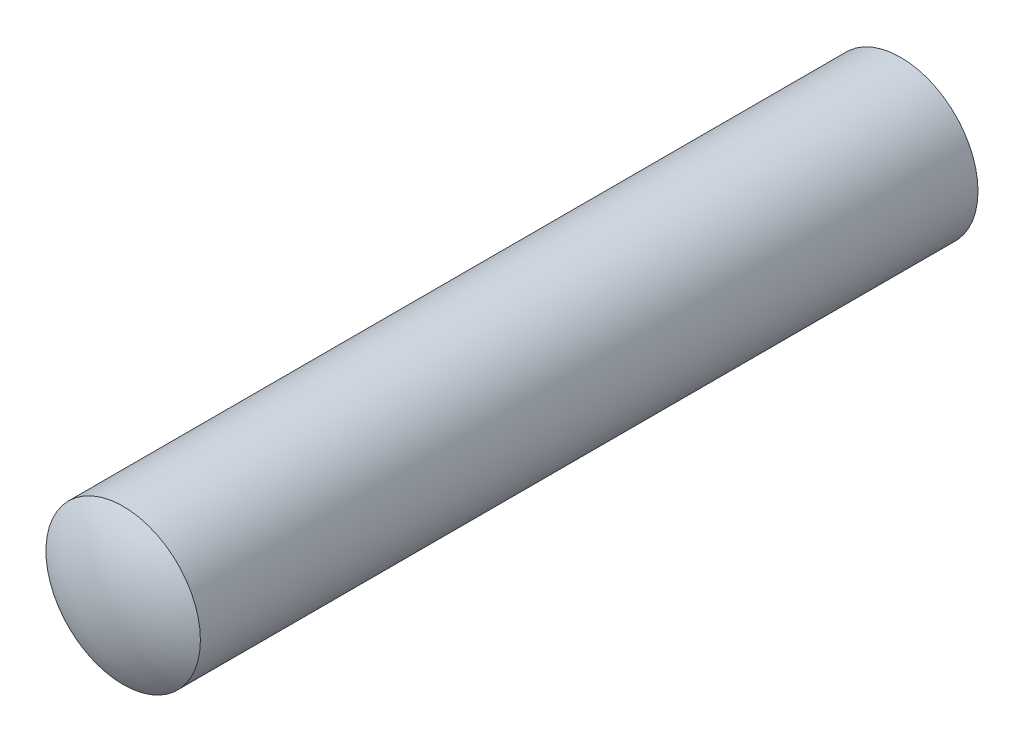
SolidWorks part; units mm, degrees
ref_plane "Plan1" through (0, 0, 0) normal (0, 0, 1) x (1, 0, 0)
ref_plane "Plan2" through (0, 0, 0) normal (0, 1, 0) x (1, 0, 0)
ref_plane "Plan3" through (0, 0, 0) normal (1, 0, 0) x (0, 0, -1)
sketch "E_corps" plane through (0, 0, 0) normal (1, 0, 0) x (0, 0, -1)
  line L0 (-10.7229, 0) -> (60.381, 0) construction
  line L1 (0, 0) -> (16, 0)
  line L2 (15.55, 1.5) -> (0.45, 1.5)
  arc A0 (0, 0) -> (0.45, 1.5) centre (2.725, 0) cw
  arc A1 (16, 0) -> (15.55, 1.5) centre (13.275, 0) ccw
revolve "Corps" add sketch "E_corps" angle 360 about L0
equation "\"D3@E_corps\" = \"C@E_corps\""
